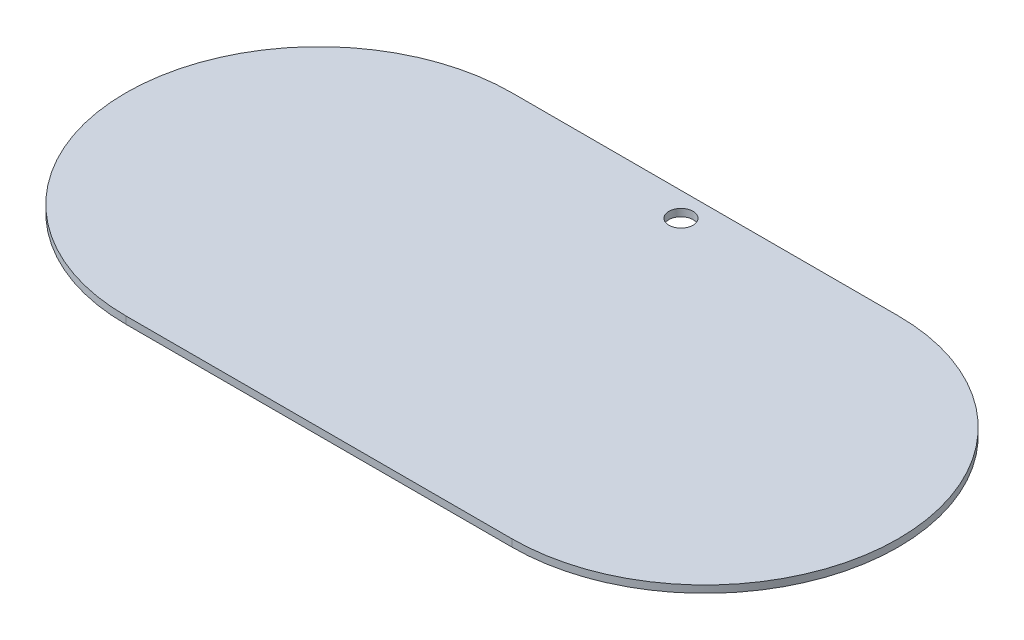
SolidWorks part; units mm, degrees
ref_plane "Front Plane" through (0, 0, 0) normal (0, 0, 1) x (1, 0, 0)
ref_plane "Top Plane" through (0, 0, 0) normal (0, 1, 0) x (1, 0, 0)
ref_plane "Right Plane" through (0, 0, 0) normal (1, 0, 0) x (0, 0, -1)
sketch "Sketch2" plane through (0, 0, 0) normal (0, 1, 0) x (1, 0, 0)
  line L0 (-50.8, 0) -> (50.8, 0) construction
  line L1 (-50.8, 50.8) -> (50.8, 50.8)
  line L2 (-50.8, -50.8) -> (50.8, -50.8)
  line L3 (-50.8, 0) -> (50.8, 0) construction
  line L4 (-50.8, 44.45) -> (50.8, 44.45) construction
  line L5 (-50.8, -44.45) -> (50.8, -44.45) construction
  arc A0 (-50.8, 50.8) -> (-50.8, -50.8) centre (-50.8, 0) ccw
  arc A1 (50.8, -50.8) -> (50.8, 50.8) centre (50.8, 0) ccw
  arc A2 (-50.8, 44.45) -> (-50.8, -44.45) centre (-50.8, 0) ccw construction
  arc A3 (50.8, -44.45) -> (50.8, 44.45) centre (50.8, 0) ccw construction
  point P2 (0, 0)
  point P9 (0, 0)
  dimension "D1" = 101.6
  dimension "D2" = 101.6
  dimension "D3" = 88.9
base flange "Base-Flange1" sketch "Sketch2" thickness 1.905 reverse thickness direction no parameters "D1"=1.6764
sketch "Sketch7" plane through (0, 0, 0) normal (0, 1, 0) x (1, 0, 0)
  line L0 (-50.8, 44.45) -> (50.8, 44.45) construction
  circle A0 centre (0, 44.45) radius 3.175
extrude "Cut-Extrude1" cut sketch "Sketch7" against normal through all both and the other way through all
sketch "Bend-Lines1" [suppressed] plane through (0, 0, 0) normal (0, 1, 0) x (1, 0, 0)
sketch "Bounding-Box1" [suppressed] plane through (0, 0, 0) normal (0, 1, 0) x (1, 0, 0)
sheet metal parameters "Sheet-Metal2" thickness 1.905 parameters "D1"=1.6764
flat pattern "Flat-Pattern2"
sketch "Bend-Lines2" plane through (0, 0, 0) normal (0, 1, 0) x (1, 0, 0)
sketch3d "Bounding-Box2" [suppressed]
  line L0 (152.4, -50.8, 0) -> (-50.8, -50.8, 0) construction
  line L1 (152.4, 50.8, 0) -> (-50.8, 50.8, 0) construction
  line L2 (152.4, -50.8, 0) -> (152.4, 50.8, 0) construction
  line L3 (-50.8, -50.8, 0) -> (-50.8, 50.8, 0) construction
sheet metal parameters "Sheet-Metal3" thickness 1.905 parameters "D1"=1.6764
flat pattern "Flat-Pattern2"
sketch "Bend-Lines2" plane through (0, 0, 0) normal (0, 1, 0) x (1, 0, 0)
sketch3d "Bounding-Box2" [suppressed]
  line L0 (152.4, -50.8, 0) -> (-50.8, -50.8, 0) construction
  line L1 (152.4, 50.8, 0) -> (-50.8, 50.8, 0) construction
  line L2 (152.4, -50.8, 0) -> (152.4, 50.8, 0) construction
  line L3 (-50.8, -50.8, 0) -> (-50.8, 50.8, 0) construction
